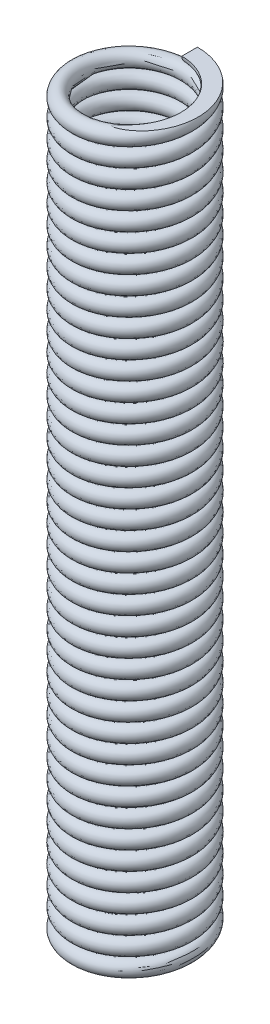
SolidWorks part; units mm, degrees
ref_plane "Front Plane" through (0, 0, 0) normal (0, 0, 1) x (1, 0, 0)
ref_plane "Top Plane" through (0, 0, 0) normal (0, 1, 0) x (1, 0, 0)
ref_plane "Right Plane" through (0, 0, 0) normal (1, 0, 0) x (0, 0, -1)
sketch "Sketch1" plane through (0, 0, 0) normal (0, 0, 1) x (1, 0, 0)
  line L0 (0, 0) -> (0, 31.0886)
  line L2 (-2.7813, 31.0886) -> (2.7813, 31.0886) construction
sketch "Sketch3" plane through (0, 0, 0) normal (1, 0, 0) x (0, 0, -1)
  line L0 (0, 0) -> (0, 31.0886) construction
  circle A0 centre (2.2987, 0) radius 0.3302
  point P2 (2.6289, 0)
  point P6 (2.2987, -0.3302)
  dimension "D1" = 0.6604
  dimension "D2" = 2.6289
sweep "Sweep1" add profiles "Sketch3" path "Sketch1" parameters "D1"=14400
ref_plane "Plane1" through (0, 31.0886, 0) normal (0, 1, 0) x (-1, 0, 0)
sketch "Sketch4" plane through (0, 0, 0) normal (0, 0, 1) x (1, 0, 0)
  line L1 (0, 31.0886) -> (3.5871, 31.0886)
  line L2 (0, 31.0886) -> (0, 32.5826)
  line L3 (0, 32.5826) -> (3.5871, 32.5826)
  line L4 (3.5871, 31.0886) -> (3.5871, 32.5826)
  line L5 (0, 0) -> (3.7166, 0)
  line L6 (0, 0) -> (0, -1.439)
  line L7 (0, -1.439) -> (3.7166, -1.439)
  line L8 (3.7166, 0) -> (3.7166, -1.439)
  dimension "D1" = 1.4941
revolve "Cut-Revolve2" cut sketch "Sketch4" angle 360 about L0
sketch "Sketch5" plane through (0, 0, 0) normal (0, -1, 0) x (1, 0, 0)
  circle A0 centre (0, 0) radius 2.5692 construction
